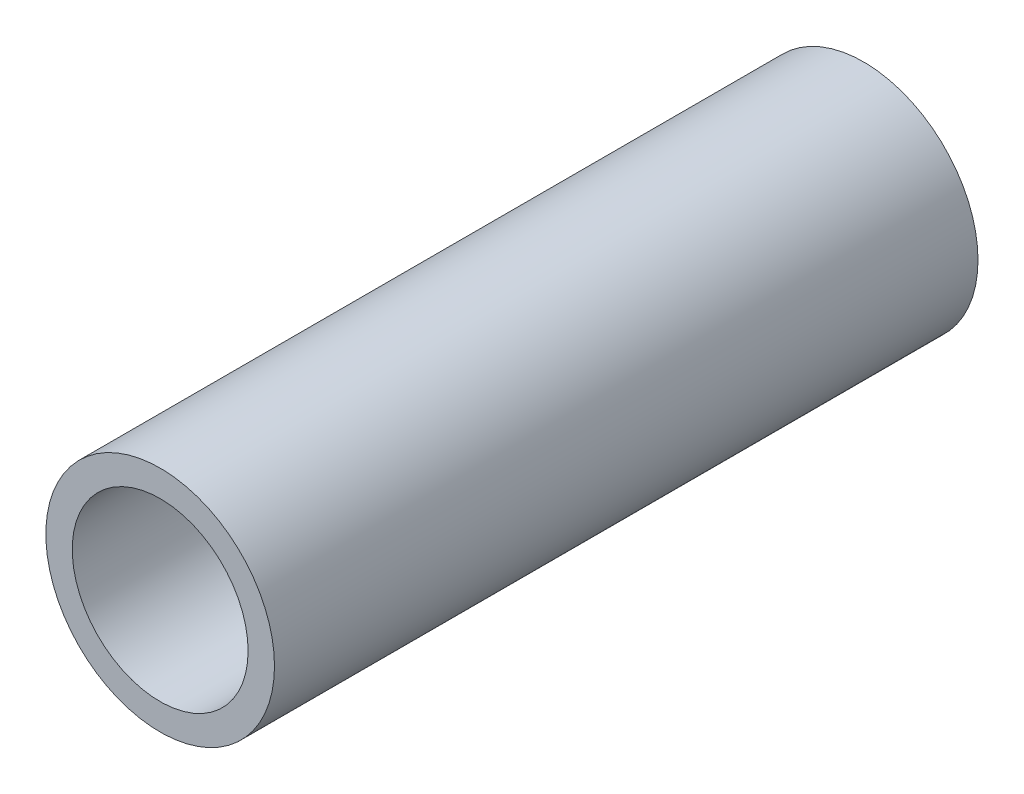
SolidWorks part; units mm, degrees
ref_plane "Front" through (0, 0, 0) normal (0, 0, 1) x (1, 0, 0)
ref_plane "Top" through (0, 0, 0) normal (0, 1, 0) x (1, 0, 0)
ref_plane "Right" through (0, 0, 0) normal (1, 0, 0) x (0, 0, -1)
sketch "Sketch1" plane through (0, 0, 0) normal (0, 0, 1) x (1, 0, 0)
  circle A0 centre (0, 0) radius 8.255
  circle A1 centre (0, 0) radius 6.35
  dimension "外径" = 16.51
  dimension "内径" = 12.7
extrude "Base-Extrude" add sketch "Sketch1" along normal blind 50.8
